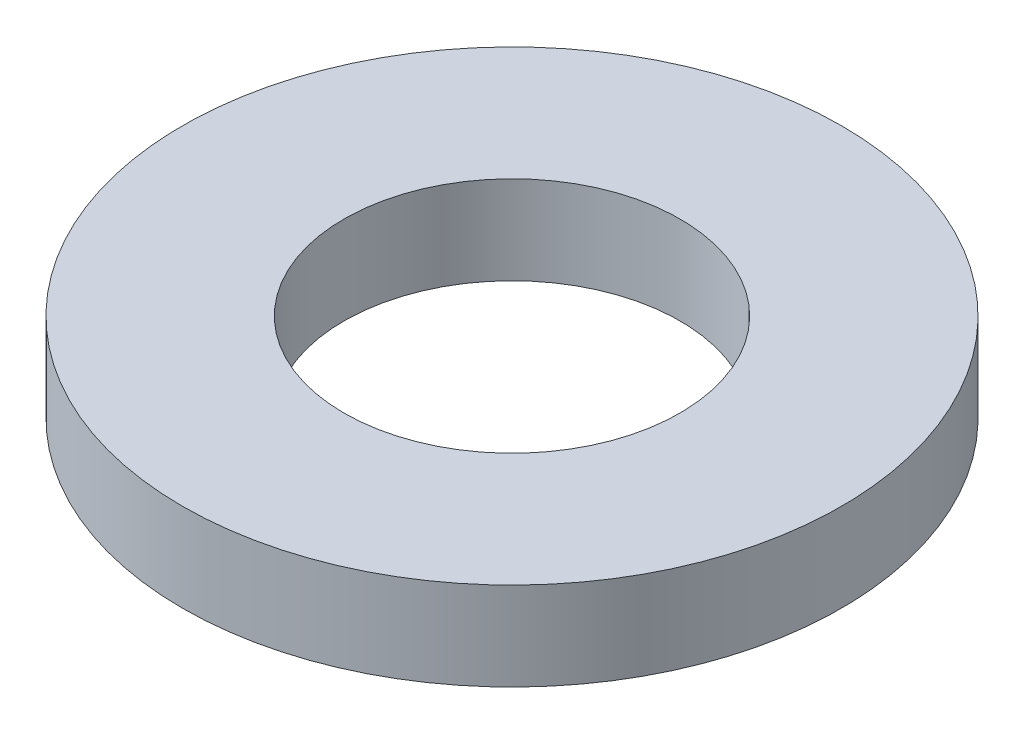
SolidWorks part; units mm, degrees
ref_plane "Front Plane" through (0, 0, 0) normal (0, 0, 1) x (1, 0, 0)
ref_plane "Top Plane" through (0, 0, 0) normal (0, 1, 0) x (1, 0, 0)
ref_plane "Right Plane" through (0, 0, 0) normal (1, 0, 0) x (0, 0, -1)
sketch "Sketch1" plane through (0, 0, 0) normal (0, 1, 0) x (1, 0, 0)
  circle A0 centre (0, 0) radius 6.35
  dimension "OD" = 12.7
extrude "Boss-Extrude1" add sketch "Sketch1" along normal blind 1.7018
sketch "Sketch5" plane through (0, 1.7018, 0) normal (0, 1, 0) x (-1, 0, 0)
  circle A0 centre (0, 0) radius 3.2385
  dimension "ID" = 6.477
extrude "Cut-Extrude1" cut sketch "Sketch5" against normal through all
